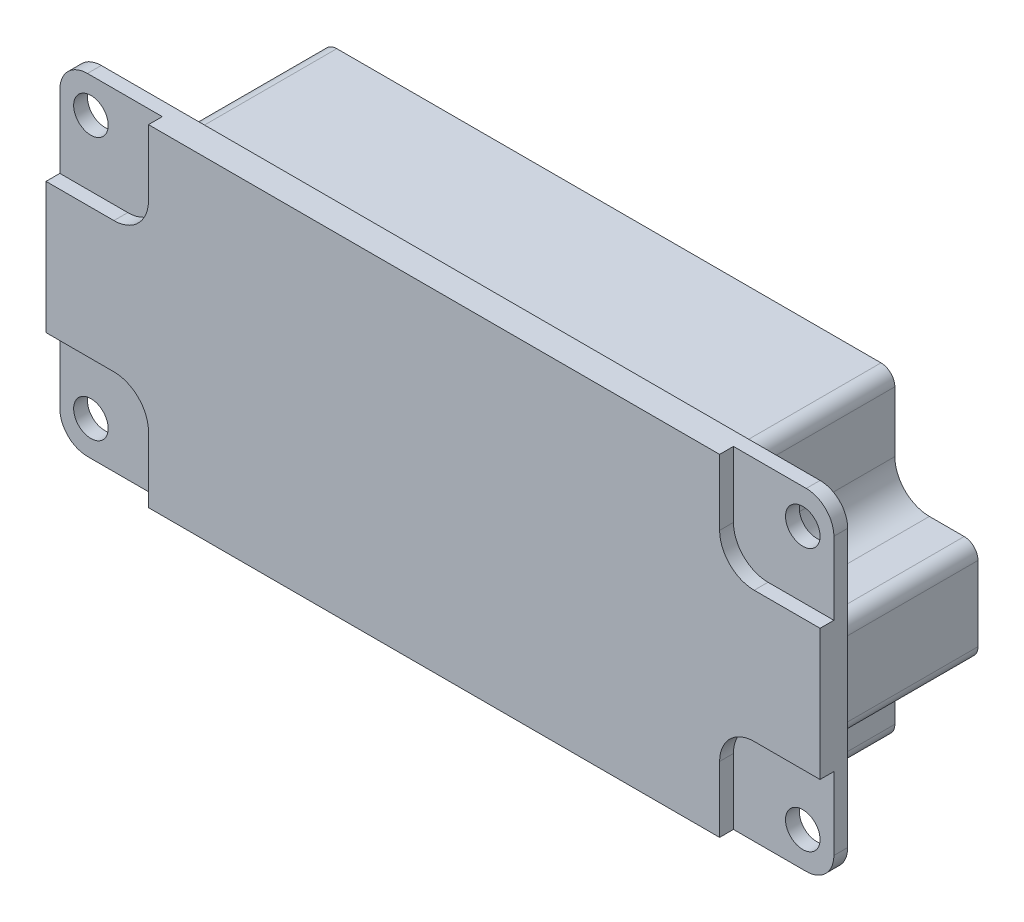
SolidWorks part; units mm, degrees
ref_plane "Plane1" through (0, 0, 0) normal (0, 0, 1) x (1, 0, 0)
ref_plane "Plane2" through (0, 0, 0) normal (0, 1, 0) x (1, 0, 0)
ref_plane "Plane3" through (0, 0, 0) normal (1, 0, 0) x (0, 0, -1)
sketch "Sketch1" plane through (0, 0, 0) normal (0, 0, 1) x (1, 0, 0)
  line L1 (33.02, -15.24) -> (-33.02, -15.24)
  line L2 (35.56, -12.7) -> (35.56, 12.7)
  line L3 (33.02, 15.24) -> (-33.02, 15.24)
  line L4 (-35.56, -12.7) -> (-35.56, 12.7)
  line L5 (35.56, -15.24) -> (-35.56, 15.24) construction
  line L6 (35.56, 15.24) -> (-35.56, -15.24) construction
  arc A0 (-33.02, -15.24) -> (-35.56, -12.7) centre (-33.02, -12.7) cw
  arc A1 (33.02, -15.24) -> (35.56, -12.7) centre (33.02, -12.7) ccw
  arc A2 (35.56, 12.7) -> (33.02, 15.24) centre (33.02, 12.7) ccw
  arc A3 (-33.02, 15.24) -> (-35.56, 12.7) centre (-33.02, 12.7) ccw
  point P0 (0, 0)
  dimension "D3" = 2.54
  dimension "D1" = 30.48
  dimension "D2" = 71.12
extrude "Boss-Extrude1" add sketch "Sketch1" along normal blind 2.54
sketch "Sketch2" plane through (0, 0, 0) normal (0, 0, -1) x (-1, 0, 0)
  line L0 (0, 0) -> (0, -22.6844) construction
  line L1 (0, 0) -> (-38.6455, 0) construction
  line L2 (-34.8312, 3.4294) -> (-34.8312, -3.4294)
  line L3 (-33.5612, -4.6994) -> (-30.3656, -4.6994)
  line L4 (-27.1906, -7.8744) -> (-27.1906, -13.4269)
  line L5 (-25.9206, -14.6969) -> (24.0815, -14.6969)
  line L6 (-25.9206, 14.6969) -> (24.0815, 14.6969)
  line L7 (-27.1906, 7.8744) -> (-27.1906, 13.4269)
  line L8 (-33.5612, 4.6994) -> (-30.3656, 4.6994)
  line L9 (-0.9196, 16.2677) -> (-0.9196, -17.22) construction
  line L10 (31.722, 4.6994) -> (28.5265, 4.6994)
  line L11 (25.3515, 7.8744) -> (25.3515, 13.4269)
  line L12 (25.3515, -7.8744) -> (25.3515, -13.4269)
  line L13 (31.722, -4.6994) -> (28.5265, -4.6994)
  line L14 (32.992, 3.4294) -> (32.992, -3.4294)
  arc A0 (-30.3656, -4.6994) -> (-27.1906, -7.8744) centre (-30.3656, -7.8744) cw
  arc A1 (-27.1906, -13.4269) -> (-25.9206, -14.6969) centre (-25.9206, -13.4269) ccw
  arc A2 (-34.8312, -3.4294) -> (-33.5612, -4.6994) centre (-33.5612, -3.4294) ccw
  arc A3 (-34.8312, 3.4294) -> (-33.5612, 4.6994) centre (-33.5612, 3.4294) cw
  arc A4 (-27.1906, 13.4269) -> (-25.9206, 14.6969) centre (-25.9206, 13.4269) cw
  arc A5 (-30.3656, 4.6994) -> (-27.1906, 7.8744) centre (-30.3656, 7.8744) ccw
  arc A6 (28.5265, 4.6994) -> (25.3515, 7.8744) centre (28.5265, 7.8744) cw
  arc A7 (25.3515, 13.4269) -> (24.0815, 14.6969) centre (24.0815, 13.4269) ccw
  arc A8 (32.992, 3.4294) -> (31.722, 4.6994) centre (31.722, 3.4294) ccw
  arc A9 (32.992, -3.4294) -> (31.722, -4.6994) centre (31.722, -3.4294) cw
  arc A10 (25.3515, -13.4269) -> (24.0815, -14.6969) centre (24.0815, -13.4269) cw
  arc A11 (28.5265, -4.6994) -> (25.3515, -7.8744) centre (28.5265, -7.8744) ccw
  point P9 (-0.9196, -14.6969)
  point P25 (-34.8312, 0)
  point P45 (32.992, 0)
  point P46 (-0.9196, 14.6969)
  dimension "D1" = 3.175
  dimension "D2" = 1.27
extrude "Boss-Extrude2" add sketch "Sketch2" along normal blind 12.7
sketch "Sketch3" plane through (0, 0, 2.54) normal (0, 0, 1) x (1, 0, 0)
  line L0 (0, 0) -> (0, -12.065) construction
  line L1 (32.7025, -12.065) -> (-32.7025, -12.065) construction
  line L2 (32.7025, -12.065) -> (32.7025, 12.065) construction
  line L3 (32.7025, 12.065) -> (-32.7025, 12.065) construction
  line L4 (-32.7025, -12.065) -> (-32.7025, 12.065) construction
  line L5 (0, 0) -> (-32.7025, 0) construction
  circle A0 centre (32.7025, -12.065) radius 1.5875
  circle A1 centre (32.7025, 12.065) radius 1.5875
  circle A2 centre (-32.7025, 12.065) radius 1.5875
  circle A3 centre (-32.7025, -12.065) radius 1.5875
  dimension "D1" = 3.175
  dimension "D2" = 65.405
  dimension "D3" = 24.13
extrude "Cut-Extrude1" cut sketch "Sketch3" against normal blind 5.08
sketch "Sketch4" plane through (0, 0, 2.54) normal (0, 0, 1) x (1, 0, 0)
  line L0 (-35.56, 12.7) -> (-35.56, -12.7) construction
  line L1 (-35.56, -6.0171) -> (-29.3192, -6.0171)
  line L2 (-35.56, -6.0171) -> (-35.56, -15.24)
  line L3 (-35.56, -15.24) -> (-26.1442, -15.24)
  line L4 (-26.1442, -9.1921) -> (-26.1442, -15.24)
  line L5 (-33.02, -15.24) -> (33.02, -15.24) construction
  line L6 (35.56, -12.7) -> (35.56, 12.7) construction
  line L7 (35.56, -6.0171) -> (29.5071, -6.0171)
  line L8 (35.56, -6.0171) -> (35.56, -15.24)
  line L9 (35.56, -15.24) -> (26.3321, -15.24)
  line L10 (26.3321, -9.1921) -> (26.3321, -15.24)
  line L11 (0, 0) -> (-6.5112, 0) construction
  line L12 (26.3321, 9.1921) -> (26.3321, 15.24)
  line L13 (35.56, 15.24) -> (26.3321, 15.24)
  line L14 (35.56, 6.0171) -> (35.56, 15.24)
  line L15 (35.56, 6.0171) -> (29.5071, 6.0171)
  line L16 (-26.1442, 9.1921) -> (-26.1442, 15.24)
  line L17 (-35.56, 15.24) -> (-26.1442, 15.24)
  line L18 (-35.56, 6.0171) -> (-35.56, 15.24)
  line L19 (-35.56, 6.0171) -> (-29.3192, 6.0171)
  arc A0 (29.5071, -6.0171) -> (26.3321, -9.1921) centre (29.5071, -9.1921) ccw
  arc A1 (-29.3192, -6.0171) -> (-26.1442, -9.1921) centre (-29.3192, -9.1921) cw
  arc A2 (-29.3192, 6.0171) -> (-26.1442, 9.1921) centre (-29.3192, 9.1921) ccw
  arc A3 (29.5071, 6.0171) -> (26.3321, 9.1921) centre (29.5071, 9.1921) cw
  dimension "D1" = 3.175
extrude "Cut-Extrude2" cut sketch "Sketch4" against normal blind 1.27
